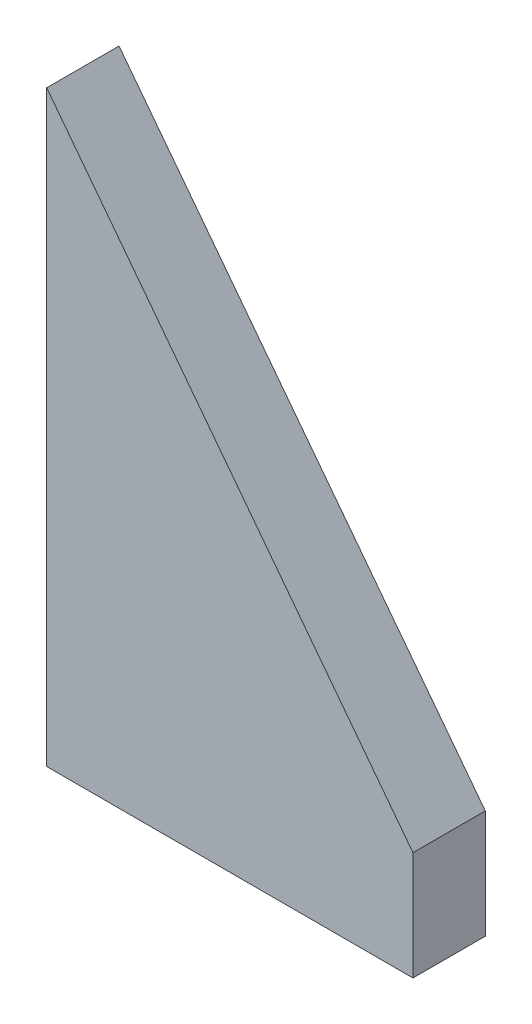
SolidWorks part; units mm, degrees
ref_plane "Plan de face" through (0, 0, 0) normal (0, 0, 1) x (1, 0, 0)
ref_plane "Plan de dessus" through (0, 0, 0) normal (0, 1, 0) x (1, 0, 0)
ref_plane "Plan de droite" through (0, 0, 0) normal (1, 0, 0) x (0, 0, -1)
sketch "Esquisse1" plane through (0, 0, 0) normal (0, 0, 1) x (1, 0, 0)
  line L0 (0, 0) -> (0, 65)
  line L1 (0, 65) -> (40.5, 12)
  line L2 (40.5, 12) -> (40.5, 0)
  line L3 (40.5, 0) -> (0, 0)
  dimension "D1" = 40.5
  dimension "D2" = 65
  dimension "D3" = 12
extrude "Extrusion1" add sketch "Esquisse1" along normal blind 8
